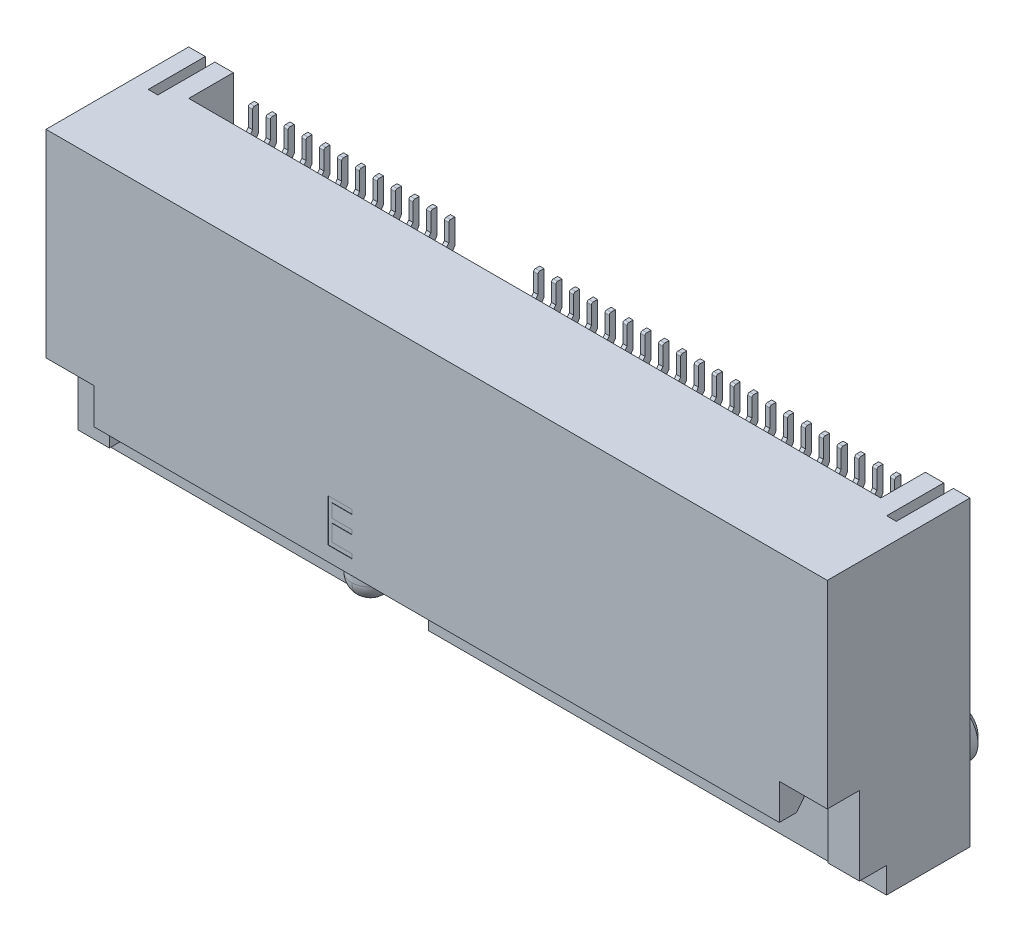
SolidWorks part; units mm, degrees
ref_plane "Front Plane" through (0, 0, 0) normal (0, 0, 1) x (1, 0, 0)
ref_plane "Top Plane" through (0, 0, 0) normal (0, 1, 0) x (1, 0, 0)
ref_plane "Right Plane" through (0, 0, 0) normal (1, 0, 0) x (0, 0, -1)
imported_body "S40BA-1-solid1"
imported_body "upper40-1-solid1"
imported_body "lower40-1-solid1"
imported_body "upper40-2-solid1"
imported_body "lower40-2-solid1"
imported_body "noflotingpad-last-1-solid1"
imported_body "noflotingpad-last-2-solid1"
imported_body "upper40-3-solid1"
imported_body "upper40-4-solid1"
imported_body "lower40-3-solid1"
imported_body "lower40-4-solid1"
imported_body "upper40-5-solid1"
imported_body "upper40-6-solid1"
imported_body "upper40-7-solid1"
imported_body "upper40-8-solid1"
imported_body "upper40-9-solid1"
imported_body "upper40-10-solid1"
imported_body "upper40-11-solid1"
imported_body "upper40-12-solid1"
imported_body "upper40-13-solid1"
imported_body "lower40-5-solid1"
imported_body "lower40-6-solid1"
imported_body "lower40-7-solid1"
imported_body "lower40-8-solid1"
imported_body "lower40-9-solid1"
imported_body "lower40-10-solid1"
imported_body "lower40-11-solid1"
imported_body "lower40-12-solid1"
imported_body "lower40-13-solid1"
imported_body "lower40-14-solid1"
imported_body "lower40-15-solid1"
imported_body "lower40-16-solid1"
imported_body "lower40-17-solid1"
imported_body "lower40-18-solid1"
imported_body "lower40-19-solid1"
imported_body "lower40-20-solid1"
imported_body "lower40-21-solid1"
imported_body "lower40-22-solid1"
imported_body "lower40-23-solid1"
imported_body "lower40-24-solid1"
imported_body "lower40-25-solid1"
imported_body "lower40-26-solid1"
imported_body "lower40-27-solid1"
imported_body "lower40-28-solid1"
imported_body "lower40-29-solid1"
imported_body "lower40-30-solid1"
imported_body "lower40-31-solid1"
imported_body "lower40-32-solid1"
imported_body "lower40-33-solid1"
imported_body "upper40-14-solid1"
imported_body "upper40-15-solid1"
imported_body "upper40-16-solid1"
imported_body "upper40-17-solid1"
imported_body "upper40-18-solid1"
imported_body "upper40-19-solid1"
imported_body "upper40-20-solid1"
imported_body "upper40-21-solid1"
imported_body "upper40-22-solid1"
imported_body "upper40-23-solid1"
imported_body "upper40-24-solid1"
imported_body "upper40-25-solid1"
imported_body "upper40-26-solid1"
imported_body "upper40-27-solid1"
imported_body "upper40-28-solid1"
imported_body "upper40-29-solid1"
imported_body "upper40-30-solid1"
imported_body "upper40-31-solid1"
imported_body "upper40-32-solid1"
imported_body "upper40-33-solid1"
imported_body "lower40-34-solid1"
imported_body "upper40-34-solid1"
sketch "Orogin_Ref" plane through (0, 0, 0) normal (0, 0, 1) x (1, 0, 0)
  line L0 (-10.95, -3.58) -> (-10.95, 2.75)
  line L1 (-10.95, 2.75) -> (10.95, 2.75)
  line L2 (10.95, 2.75) -> (10.95, -3.58)
  line L3 (10.95, -3.58) -> (-10.95, -3.58)
  line L4 (-9.8553, 5.1479) -> (-9.2553, 4.5479)
  line L5 (-9.2553, 4.5479) -> (-8.6553, 5.1479)
  line L6 (-8.6553, 5.1479) -> (-9.8553, 5.1479)
  line L7 (-1.905, 0) -> (1.905, 0)
  line L8 (0, -1.905) -> (0, 1.905)
  line L9 (-9.4, 2.7) -> (-9.4, 4.25)
  line L10 (-9.4, 4.25) -> (-9.1, 4.25)
  line L11 (-9.1, 4.25) -> (-9.1, 2.7)
  line L12 (-9.1, 2.7) -> (-9.4, 2.7)
  line L13 (-8.9, 2.7) -> (-8.9, 4.25)
  line L14 (-8.9, 4.25) -> (-8.6, 4.25)
  line L15 (-8.6, 4.25) -> (-8.6, 2.7)
  line L16 (-8.6, 2.7) -> (-8.9, 2.7)
  line L17 (-8.4, 2.7) -> (-8.4, 4.25)
  line L18 (-8.4, 4.25) -> (-8.1, 4.25)
  line L19 (-8.1, 4.25) -> (-8.1, 2.7)
  line L20 (-8.1, 2.7) -> (-8.4, 2.7)
  line L21 (-7.9, 2.7) -> (-7.9, 4.25)
  line L22 (-7.9, 4.25) -> (-7.6, 4.25)
  line L23 (-7.6, 4.25) -> (-7.6, 2.7)
  line L24 (-7.6, 2.7) -> (-7.9, 2.7)
  line L25 (-7.4, 2.7) -> (-7.4, 4.25)
  line L26 (-7.4, 4.25) -> (-7.1, 4.25)
  line L27 (-7.1, 4.25) -> (-7.1, 2.7)
  line L28 (-7.1, 2.7) -> (-7.4, 2.7)
  line L29 (-6.9, 2.7) -> (-6.9, 4.25)
  line L30 (-6.9, 4.25) -> (-6.6, 4.25)
  line L31 (-6.6, 4.25) -> (-6.6, 2.7)
  line L32 (-6.6, 2.7) -> (-6.9, 2.7)
  line L33 (-6.4, 2.7) -> (-6.4, 4.25)
  line L34 (-6.4, 4.25) -> (-6.1, 4.25)
  line L35 (-6.1, 4.25) -> (-6.1, 2.7)
  line L36 (-6.1, 2.7) -> (-6.4, 2.7)
  line L37 (-5.9, 2.7) -> (-5.9, 4.25)
  line L38 (-5.9, 4.25) -> (-5.6, 4.25)
  line L39 (-5.6, 4.25) -> (-5.6, 2.7)
  line L40 (-5.6, 2.7) -> (-5.9, 2.7)
  line L41 (-5.4, 2.7) -> (-5.4, 4.25)
  line L42 (-5.4, 4.25) -> (-5.1, 4.25)
  line L43 (-5.1, 4.25) -> (-5.1, 2.7)
  line L44 (-5.1, 2.7) -> (-5.4, 2.7)
  line L45 (-4.9, 2.7) -> (-4.9, 4.25)
  line L46 (-4.9, 4.25) -> (-4.6, 4.25)
  line L47 (-4.6, 4.25) -> (-4.6, 2.7)
  line L48 (-4.6, 2.7) -> (-4.9, 2.7)
  line L49 (-4.4, 2.7) -> (-4.4, 4.25)
  line L50 (-4.4, 4.25) -> (-4.1, 4.25)
  line L51 (-4.1, 4.25) -> (-4.1, 2.7)
  line L52 (-4.1, 2.7) -> (-4.4, 2.7)
  line L53 (-3.9, 2.7) -> (-3.9, 4.25)
  line L54 (-3.9, 4.25) -> (-3.6, 4.25)
  line L55 (-3.6, 4.25) -> (-3.6, 2.7)
  line L56 (-3.6, 2.7) -> (-3.9, 2.7)
  line L57 (-1.4, 2.7) -> (-1.4, 4.25)
  line L58 (-1.4, 4.25) -> (-1.1, 4.25)
  line L59 (-1.1, 4.25) -> (-1.1, 2.7)
  line L60 (-1.1, 2.7) -> (-1.4, 2.7)
  line L61 (-0.9, 2.7) -> (-0.9, 4.25)
  line L62 (-0.9, 4.25) -> (-0.6, 4.25)
  line L63 (-0.6, 4.25) -> (-0.6, 2.7)
  line L64 (-0.6, 2.7) -> (-0.9, 2.7)
  line L65 (-0.4, 2.7) -> (-0.4, 4.25)
  line L66 (-0.4, 4.25) -> (-0.1, 4.25)
  line L67 (-0.1, 4.25) -> (-0.1, 2.7)
  line L68 (-0.1, 2.7) -> (-0.4, 2.7)
  line L69 (0.1, 2.7) -> (0.1, 4.25)
  line L70 (0.1, 4.25) -> (0.4, 4.25)
  line L71 (0.4, 4.25) -> (0.4, 2.7)
  line L72 (0.4, 2.7) -> (0.1, 2.7)
  line L73 (0.6, 2.7) -> (0.6, 4.25)
  line L74 (0.6, 4.25) -> (0.9, 4.25)
  line L75 (0.9, 4.25) -> (0.9, 2.7)
  line L76 (0.9, 2.7) -> (0.6, 2.7)
  line L77 (1.1, 2.7) -> (1.1, 4.25)
  line L78 (1.1, 4.25) -> (1.4, 4.25)
  line L79 (1.4, 4.25) -> (1.4, 2.7)
  line L80 (1.4, 2.7) -> (1.1, 2.7)
  line L81 (1.6, 2.7) -> (1.6, 4.25)
  line L82 (1.6, 4.25) -> (1.9, 4.25)
  line L83 (1.9, 4.25) -> (1.9, 2.7)
  line L84 (1.9, 2.7) -> (1.6, 2.7)
  line L85 (2.1, 2.7) -> (2.1, 4.25)
  line L86 (2.1, 4.25) -> (2.4, 4.25)
  line L87 (2.4, 4.25) -> (2.4, 2.7)
  line L88 (2.4, 2.7) -> (2.1, 2.7)
  line L89 (2.6, 2.7) -> (2.6, 4.25)
  line L90 (2.6, 4.25) -> (2.9, 4.25)
  line L91 (2.9, 4.25) -> (2.9, 2.7)
  line L92 (2.9, 2.7) -> (2.6, 2.7)
  line L93 (3.1, 2.7) -> (3.1, 4.25)
  line L94 (3.1, 4.25) -> (3.4, 4.25)
  line L95 (3.4, 4.25) -> (3.4, 2.7)
  line L96 (3.4, 2.7) -> (3.1, 2.7)
  line L97 (3.6, 2.7) -> (3.6, 4.25)
  line L98 (3.6, 4.25) -> (3.9, 4.25)
  line L99 (3.9, 4.25) -> (3.9, 2.7)
  line L100 (3.9, 2.7) -> (3.6, 2.7)
  line L101 (4.1, 2.7) -> (4.1, 4.25)
  line L102 (4.1, 4.25) -> (4.4, 4.25)
  line L103 (4.4, 4.25) -> (4.4, 2.7)
  line L104 (4.4, 2.7) -> (4.1, 2.7)
  line L105 (4.6, 2.7) -> (4.6, 4.25)
  line L106 (4.6, 4.25) -> (4.9, 4.25)
  line L107 (4.9, 4.25) -> (4.9, 2.7)
  line L108 (4.9, 2.7) -> (4.6, 2.7)
  line L109 (5.1, 2.7) -> (5.1, 4.25)
  line L110 (5.1, 4.25) -> (5.4, 4.25)
  line L111 (5.4, 4.25) -> (5.4, 2.7)
  line L112 (5.4, 2.7) -> (5.1, 2.7)
  line L113 (5.6, 2.7) -> (5.6, 4.25)
  line L114 (5.6, 4.25) -> (5.9, 4.25)
  line L115 (5.9, 4.25) -> (5.9, 2.7)
  line L116 (5.9, 2.7) -> (5.6, 2.7)
  line L117 (6.1, 2.7) -> (6.1, 4.25)
  line L118 (6.1, 4.25) -> (6.4, 4.25)
  line L119 (6.4, 4.25) -> (6.4, 2.7)
  line L120 (6.4, 2.7) -> (6.1, 2.7)
  line L121 (6.6, 2.7) -> (6.6, 4.25)
  line L122 (6.6, 4.25) -> (6.9, 4.25)
  line L123 (6.9, 4.25) -> (6.9, 2.7)
  line L124 (6.9, 2.7) -> (6.6, 2.7)
  line L125 (7.1, 2.7) -> (7.1, 4.25)
  line L126 (7.1, 4.25) -> (7.4, 4.25)
  line L127 (7.4, 4.25) -> (7.4, 2.7)
  line L128 (7.4, 2.7) -> (7.1, 2.7)
  line L129 (7.6, 2.7) -> (7.6, 4.25)
  line L130 (7.6, 4.25) -> (7.9, 4.25)
  line L131 (7.9, 4.25) -> (7.9, 2.7)
  line L132 (7.9, 2.7) -> (7.6, 2.7)
  line L133 (8.1, 2.7) -> (8.1, 4.25)
  line L134 (8.1, 4.25) -> (8.4, 4.25)
  line L135 (8.4, 4.25) -> (8.4, 2.7)
  line L136 (8.4, 2.7) -> (8.1, 2.7)
  line L137 (8.6, 2.7) -> (8.6, 4.25)
  line L138 (8.6, 4.25) -> (8.9, 4.25)
  line L139 (8.9, 4.25) -> (8.9, 2.7)
  line L140 (8.9, 2.7) -> (8.6, 2.7)
  line L141 (9.1, 2.7) -> (9.1, 4.25)
  line L142 (9.1, 4.25) -> (9.4, 4.25)
  line L143 (9.4, 4.25) -> (9.4, 2.7)
  line L144 (9.4, 2.7) -> (9.1, 2.7)
  line L145 (-9.15, -4.75) -> (-9.15, -3.2)
  line L146 (-9.15, -3.2) -> (-8.85, -3.2)
  line L147 (-8.85, -3.2) -> (-8.85, -4.75)
  line L148 (-8.85, -4.75) -> (-9.15, -4.75)
  line L149 (-8.65, -4.75) -> (-8.65, -3.2)
  line L150 (-8.65, -3.2) -> (-8.35, -3.2)
  line L151 (-8.35, -3.2) -> (-8.35, -4.75)
  line L152 (-8.35, -4.75) -> (-8.65, -4.75)
  line L153 (-8.15, -4.75) -> (-8.15, -3.2)
  line L154 (-8.15, -3.2) -> (-7.85, -3.2)
  line L155 (-7.85, -3.2) -> (-7.85, -4.75)
  line L156 (-7.85, -4.75) -> (-8.15, -4.75)
  line L157 (-7.65, -4.75) -> (-7.65, -3.2)
  line L158 (-7.65, -3.2) -> (-7.35, -3.2)
  line L159 (-7.35, -3.2) -> (-7.35, -4.75)
  line L160 (-7.35, -4.75) -> (-7.65, -4.75)
  line L161 (-7.15, -4.75) -> (-7.15, -3.2)
  line L162 (-7.15, -3.2) -> (-6.85, -3.2)
  line L163 (-6.85, -3.2) -> (-6.85, -4.75)
  line L164 (-6.85, -4.75) -> (-7.15, -4.75)
  line L165 (-6.65, -4.75) -> (-6.65, -3.2)
  line L166 (-6.65, -3.2) -> (-6.35, -3.2)
  line L167 (-6.35, -3.2) -> (-6.35, -4.75)
  line L168 (-6.35, -4.75) -> (-6.65, -4.75)
  line L169 (-6.15, -4.75) -> (-6.15, -3.2)
  line L170 (-6.15, -3.2) -> (-5.85, -3.2)
  line L171 (-5.85, -3.2) -> (-5.85, -4.75)
  line L172 (-5.85, -4.75) -> (-6.15, -4.75)
  line L173 (-5.65, -4.75) -> (-5.65, -3.2)
  line L174 (-5.65, -3.2) -> (-5.35, -3.2)
  line L175 (-5.35, -3.2) -> (-5.35, -4.75)
  line L176 (-5.35, -4.75) -> (-5.65, -4.75)
  line L177 (-5.15, -4.75) -> (-5.15, -3.2)
  line L178 (-5.15, -3.2) -> (-4.85, -3.2)
  line L179 (-4.85, -3.2) -> (-4.85, -4.75)
  line L180 (-4.85, -4.75) -> (-5.15, -4.75)
  line L181 (-4.65, -4.75) -> (-4.65, -3.2)
  line L182 (-4.65, -3.2) -> (-4.35, -3.2)
  line L183 (-4.35, -3.2) -> (-4.35, -4.75)
  line L184 (-4.35, -4.75) -> (-4.65, -4.75)
  line L185 (-4.15, -4.75) -> (-4.15, -3.2)
  line L186 (-4.15, -3.2) -> (-3.85, -3.2)
  line L187 (-3.85, -3.2) -> (-3.85, -4.75)
  line L188 (-3.85, -4.75) -> (-4.15, -4.75)
  line L189 (-1.65, -4.75) -> (-1.65, -3.2)
  line L190 (-1.65, -3.2) -> (-1.35, -3.2)
  line L191 (-1.35, -3.2) -> (-1.35, -4.75)
  line L192 (-1.35, -4.75) -> (-1.65, -4.75)
  line L193 (-1.15, -4.75) -> (-1.15, -3.2)
  line L194 (-1.15, -3.2) -> (-0.85, -3.2)
  line L195 (-0.85, -3.2) -> (-0.85, -4.75)
  line L196 (-0.85, -4.75) -> (-1.15, -4.75)
  line L197 (-0.65, -4.75) -> (-0.65, -3.2)
  line L198 (-0.65, -3.2) -> (-0.35, -3.2)
  line L199 (-0.35, -3.2) -> (-0.35, -4.75)
  line L200 (-0.35, -4.75) -> (-0.65, -4.75)
  line L201 (-0.15, -4.75) -> (-0.15, -3.2)
  line L202 (-0.15, -3.2) -> (0.15, -3.2)
  line L203 (0.15, -3.2) -> (0.15, -4.75)
  line L204 (0.15, -4.75) -> (-0.15, -4.75)
  line L205 (0.35, -4.75) -> (0.35, -3.2)
  line L206 (0.35, -3.2) -> (0.65, -3.2)
  line L207 (0.65, -3.2) -> (0.65, -4.75)
  line L208 (0.65, -4.75) -> (0.35, -4.75)
  line L209 (0.85, -4.75) -> (0.85, -3.2)
  line L210 (0.85, -3.2) -> (1.15, -3.2)
  line L211 (1.15, -3.2) -> (1.15, -4.75)
  line L212 (1.15, -4.75) -> (0.85, -4.75)
  line L213 (1.35, -4.75) -> (1.35, -3.2)
  line L214 (1.35, -3.2) -> (1.65, -3.2)
  line L215 (1.65, -3.2) -> (1.65, -4.75)
  line L216 (1.65, -4.75) -> (1.35, -4.75)
  line L217 (1.85, -4.75) -> (1.85, -3.2)
  line L218 (1.85, -3.2) -> (2.15, -3.2)
  line L219 (2.15, -3.2) -> (2.15, -4.75)
  line L220 (2.15, -4.75) -> (1.85, -4.75)
  line L221 (2.35, -4.75) -> (2.35, -3.2)
  line L222 (2.35, -3.2) -> (2.65, -3.2)
  line L223 (2.65, -3.2) -> (2.65, -4.75)
  line L224 (2.65, -4.75) -> (2.35, -4.75)
  line L225 (2.85, -4.75) -> (2.85, -3.2)
  line L226 (2.85, -3.2) -> (3.15, -3.2)
  line L227 (3.15, -3.2) -> (3.15, -4.75)
  line L228 (3.15, -4.75) -> (2.85, -4.75)
  line L229 (3.35, -4.75) -> (3.35, -3.2)
  line L230 (3.35, -3.2) -> (3.65, -3.2)
  line L231 (3.65, -3.2) -> (3.65, -4.75)
  line L232 (3.65, -4.75) -> (3.35, -4.75)
  line L233 (3.85, -4.75) -> (3.85, -3.2)
  line L234 (3.85, -3.2) -> (4.15, -3.2)
  line L235 (4.15, -3.2) -> (4.15, -4.75)
  line L236 (4.15, -4.75) -> (3.85, -4.75)
  line L237 (4.35, -4.75) -> (4.35, -3.2)
  line L238 (4.35, -3.2) -> (4.65, -3.2)
  line L239 (4.65, -3.2) -> (4.65, -4.75)
  line L240 (4.65, -4.75) -> (4.35, -4.75)
  line L241 (4.85, -4.75) -> (4.85, -3.2)
  line L242 (4.85, -3.2) -> (5.15, -3.2)
  line L243 (5.15, -3.2) -> (5.15, -4.75)
  line L244 (5.15, -4.75) -> (4.85, -4.75)
  line L245 (5.35, -4.75) -> (5.35, -3.2)
  line L246 (5.35, -3.2) -> (5.65, -3.2)
  line L247 (5.65, -3.2) -> (5.65, -4.75)
  line L248 (5.65, -4.75) -> (5.35, -4.75)
  line L249 (5.85, -4.75) -> (5.85, -3.2)
  line L250 (5.85, -3.2) -> (6.15, -3.2)
  line L251 (6.15, -3.2) -> (6.15, -4.75)
  line L252 (6.15, -4.75) -> (5.85, -4.75)
  line L253 (6.35, -4.75) -> (6.35, -3.2)
  line L254 (6.35, -3.2) -> (6.65, -3.2)
  line L255 (6.65, -3.2) -> (6.65, -4.75)
  line L256 (6.65, -4.75) -> (6.35, -4.75)
  line L257 (6.85, -4.75) -> (6.85, -3.2)
  line L258 (6.85, -3.2) -> (7.15, -3.2)
  line L259 (7.15, -3.2) -> (7.15, -4.75)
  line L260 (7.15, -4.75) -> (6.85, -4.75)
  line L261 (7.35, -4.75) -> (7.35, -3.2)
  line L262 (7.35, -3.2) -> (7.65, -3.2)
  line L263 (7.65, -3.2) -> (7.65, -4.75)
  line L264 (7.65, -4.75) -> (7.35, -4.75)
  line L265 (7.85, -4.75) -> (7.85, -3.2)
  line L266 (7.85, -3.2) -> (8.15, -3.2)
  line L267 (8.15, -3.2) -> (8.15, -4.75)
  line L268 (8.15, -4.75) -> (7.85, -4.75)
  line L269 (8.35, -4.75) -> (8.35, -3.2)
  line L270 (8.35, -3.2) -> (8.65, -3.2)
  line L271 (8.65, -3.2) -> (8.65, -4.75)
  line L272 (8.65, -4.75) -> (8.35, -4.75)
  line L273 (8.85, -4.75) -> (8.85, -3.2)
  line L274 (8.85, -3.2) -> (9.15, -3.2)
  line L275 (9.15, -3.2) -> (9.15, -4.75)
  line L276 (9.15, -4.75) -> (8.85, -4.75)
  line L277 (-10.95, 1.375) -> (-10.95, 4.125)
  line L278 (-10.95, 4.125) -> (-9.75, 4.125)
  line L279 (-9.75, 4.125) -> (-9.75, 1.375)
  line L280 (-9.75, 1.375) -> (-10.95, 1.375)
  line L281 (9.75, 1.375) -> (9.75, 4.125)
  line L282 (9.75, 4.125) -> (10.95, 4.125)
  line L283 (10.95, 4.125) -> (10.95, 1.375)
  line L284 (10.95, 1.375) -> (9.75, 1.375)
  line L285 (-10.95, -3.58) -> (-10.95, 2.75)
  line L286 (-10.95, 2.75) -> (10.95, 2.75)
  line L287 (10.95, 2.75) -> (10.95, -3.58)
  line L288 (10.95, -3.58) -> (-10.95, -3.58)
  line L289 (-9.25, 4.25) -> (-9.25, 2.7) construction
  circle A0 centre (0, 0) radius 1
  text T0 "B" font "ARIAL" height 1
  text T1 "1" font "COURIER NEW" height 0.508
  text T2 "3" font "COURIER NEW" height 0.508
  text T3 "5" font "COURIER NEW" height 0.508
  text T4 "7" font "COURIER NEW" height 0.508
  text T5 "9" font "COURIER NEW" height 0.508
  text T6 "11" font "COURIER NEW" height 0.508
  text T7 "13" font "COURIER NEW" height 0.508
  text T8 "15" font "COURIER NEW" height 0.508
  text T9 "17" font "COURIER NEW" height 0.508
  text T10 "19" font "COURIER NEW" height 0.508
  text T11 "21" font "COURIER NEW" height 0.508
  text T12 "23" font "COURIER NEW" height 0.508
  text T13 "33" font "COURIER NEW" height 0.508
  text T14 "35" font "COURIER NEW" height 0.508
  text T15 "37" font "COURIER NEW" height 0.508
  text T16 "39" font "COURIER NEW" height 0.508
  text T17 "41" font "COURIER NEW" height 0.508
  text T18 "43" font "COURIER NEW" height 0.508
  text T19 "45" font "COURIER NEW" height 0.508
  text T20 "47" font "COURIER NEW" height 0.508
  text T21 "49" font "COURIER NEW" height 0.508
  text T22 "51" font "COURIER NEW" height 0.508
  text T23 "53" font "COURIER NEW" height 0.508
  text T24 "55" font "COURIER NEW" height 0.508
  text T25 "57" font "COURIER NEW" height 0.508
  text T26 "59" font "COURIER NEW" height 0.508
  text T27 "61" font "COURIER NEW" height 0.508
  text T28 "63" font "COURIER NEW" height 0.508
  text T29 "65" font "COURIER NEW" height 0.508
  text T30 "67" font "COURIER NEW" height 0.508
  text T31 "69" font "COURIER NEW" height 0.508
  text T32 "71" font "COURIER NEW" height 0.508
  text T33 "73" font "COURIER NEW" height 0.508
  text T34 "75" font "COURIER NEW" height 0.508
  text T35 "2" font "COURIER NEW" height 0.508
  text T36 "4" font "COURIER NEW" height 0.508
  text T37 "6" font "COURIER NEW" height 0.508
  text T38 "8" font "COURIER NEW" height 0.508
  text T39 "10" font "COURIER NEW" height 0.508
  text T40 "12" font "COURIER NEW" height 0.508
  text T41 "14" font "COURIER NEW" height 0.508
  text T42 "16" font "COURIER NEW" height 0.508
  text T43 "18" font "COURIER NEW" height 0.508
  text T44 "20" font "COURIER NEW" height 0.508
  text T45 "22" font "COURIER NEW" height 0.508
  text T46 "32" font "COURIER NEW" height 0.508
  text T47 "34" font "COURIER NEW" height 0.508
  text T48 "36" font "COURIER NEW" height 0.508
  text T49 "38" font "COURIER NEW" height 0.508
  text T50 "40" font "COURIER NEW" height 0.508
  text T51 "42" font "COURIER NEW" height 0.508
  text T52 "44" font "COURIER NEW" height 0.508
  text T53 "46" font "COURIER NEW" height 0.508
  text T54 "48" font "COURIER NEW" height 0.508
  text T55 "50" font "COURIER NEW" height 0.508
  text T56 "52" font "COURIER NEW" height 0.508
  text T57 "54" font "COURIER NEW" height 0.508
  text T58 "56" font "COURIER NEW" height 0.508
  text T59 "58" font "COURIER NEW" height 0.508
  text T60 "60" font "COURIER NEW" height 0.508
  text T61 "62" font "COURIER NEW" height 0.508
  text T62 "64" font "COURIER NEW" height 0.508
  text T63 "66" font "COURIER NEW" height 0.508
  text T64 "68" font "COURIER NEW" height 0.508
  text T65 "70" font "COURIER NEW" height 0.508
  text T66 "72" font "COURIER NEW" height 0.508
  text T67 "74" font "COURIER NEW" height 0.508
  text T68 "NC1" font "COURIER NEW" height 0.508
  text T69 "NC2" font "COURIER NEW" height 0.508
sketch "Origin_Ref" plane through (130.0926, -40.2153, 0) normal (0, 0, 1) x (0, 1, 0)
  line L286 (37.0153, 134.2426) -> (35.4653, 134.2426)
  line L287 (37.0153, 133.9426) -> (37.0153, 134.2426)
  line L288 (35.4653, 133.9426) -> (37.0153, 133.9426)
  line L289 (35.4653, 134.2426) -> (35.4653, 133.9426)
  line L290 (37.0153, 134.7426) -> (35.4653, 134.7426)
  line L291 (37.0153, 134.4426) -> (37.0153, 134.7426)
  line L292 (35.4653, 134.4426) -> (37.0153, 134.4426)
  line L293 (35.4653, 134.7426) -> (35.4653, 134.4426)
  line L294 (37.0153, 121.2426) -> (35.4653, 121.2426)
  line L295 (37.0153, 120.9426) -> (37.0153, 121.2426)
  line L296 (35.4653, 120.9426) -> (37.0153, 120.9426)
  line L297 (35.4653, 121.2426) -> (35.4653, 120.9426)
  line L298 (37.0153, 121.7426) -> (35.4653, 121.7426)
  line L299 (37.0153, 121.4426) -> (37.0153, 121.7426)
  line L300 (35.4653, 121.4426) -> (37.0153, 121.4426)
  line L301 (35.4653, 121.7426) -> (35.4653, 121.4426)
  line L302 (37.0153, 122.2426) -> (35.4653, 122.2426)
  line L303 (37.0153, 121.9426) -> (37.0153, 122.2426)
  line L304 (35.4653, 121.9426) -> (37.0153, 121.9426)
  line L305 (35.4653, 122.2426) -> (35.4653, 121.9426)
  line L306 (37.0153, 122.7426) -> (35.4653, 122.7426)
  line L307 (37.0153, 122.4426) -> (37.0153, 122.7426)
  line L308 (35.4653, 122.4426) -> (37.0153, 122.4426)
  line L309 (35.4653, 122.7426) -> (35.4653, 122.4426)
  line L310 (37.0153, 123.2426) -> (35.4653, 123.2426)
  line L311 (37.0153, 122.9426) -> (37.0153, 123.2426)
  line L312 (35.4653, 122.9426) -> (37.0153, 122.9426)
  line L313 (35.4653, 123.2426) -> (35.4653, 122.9426)
  line L314 (37.0153, 123.7426) -> (35.4653, 123.7426)
  line L315 (37.0153, 123.4426) -> (37.0153, 123.7426)
  line L316 (35.4653, 123.4426) -> (37.0153, 123.4426)
  line L317 (35.4653, 123.7426) -> (35.4653, 123.4426)
  line L318 (37.0153, 124.2426) -> (35.4653, 124.2426)
  line L319 (37.0153, 123.9426) -> (37.0153, 124.2426)
  line L320 (35.4653, 123.9426) -> (37.0153, 123.9426)
  line L321 (35.4653, 124.2426) -> (35.4653, 123.9426)
  line L322 (37.0153, 124.7426) -> (35.4653, 124.7426)
  line L323 (37.0153, 124.4426) -> (37.0153, 124.7426)
  line L324 (35.4653, 124.4426) -> (37.0153, 124.4426)
  line L325 (35.4653, 124.7426) -> (35.4653, 124.4426)
  line L326 (37.0153, 125.2426) -> (35.4653, 125.2426)
  line L327 (37.0153, 124.9426) -> (37.0153, 125.2426)
  line L328 (35.4653, 124.9426) -> (37.0153, 124.9426)
  line L329 (35.4653, 125.2426) -> (35.4653, 124.9426)
  line L330 (37.0153, 125.7426) -> (35.4653, 125.7426)
  line L331 (37.0153, 125.4426) -> (37.0153, 125.7426)
  line L332 (35.4653, 125.4426) -> (37.0153, 125.4426)
  line L333 (35.4653, 125.7426) -> (35.4653, 125.4426)
  line L334 (37.0153, 126.2426) -> (35.4653, 126.2426)
  line L335 (37.0153, 125.9426) -> (37.0153, 126.2426)
  line L336 (35.4653, 125.9426) -> (37.0153, 125.9426)
  line L337 (35.4653, 126.2426) -> (35.4653, 125.9426)
  line L338 (37.0153, 126.7426) -> (35.4653, 126.7426)
  line L339 (37.0153, 126.4426) -> (37.0153, 126.7426)
  line L340 (35.4653, 126.4426) -> (37.0153, 126.4426)
  line L341 (35.4653, 126.7426) -> (35.4653, 126.4426)
  line L342 (37.0153, 127.2426) -> (35.4653, 127.2426)
  line L343 (37.0153, 126.9426) -> (37.0153, 127.2426)
  line L344 (35.4653, 126.9426) -> (37.0153, 126.9426)
  line L345 (35.4653, 127.2426) -> (35.4653, 126.9426)
  line L346 (37.0153, 127.7426) -> (35.4653, 127.7426)
  line L347 (37.0153, 127.4426) -> (37.0153, 127.7426)
  line L348 (35.4653, 127.4426) -> (37.0153, 127.4426)
  line L349 (35.4653, 127.7426) -> (35.4653, 127.4426)
  line L350 (37.0153, 128.2426) -> (35.4653, 128.2426)
  line L351 (37.0153, 127.9426) -> (37.0153, 128.2426)
  line L352 (35.4653, 127.9426) -> (37.0153, 127.9426)
  line L353 (35.4653, 128.2426) -> (35.4653, 127.9426)
  line L354 (37.0153, 128.7426) -> (35.4653, 128.7426)
  line L355 (37.0153, 128.4426) -> (37.0153, 128.7426)
  line L356 (35.4653, 128.4426) -> (37.0153, 128.4426)
  line L357 (35.4653, 128.7426) -> (35.4653, 128.4426)
  line L358 (37.0153, 135.2426) -> (35.4653, 135.2426)
  line L359 (37.0153, 134.9426) -> (37.0153, 135.2426)
  line L360 (35.4653, 134.9426) -> (37.0153, 134.9426)
  line L361 (35.4653, 135.2426) -> (35.4653, 134.9426)
  line L362 (37.0153, 135.7426) -> (35.4653, 135.7426)
  line L363 (37.0153, 135.4426) -> (37.0153, 135.7426)
  line L364 (35.4653, 135.4426) -> (37.0153, 135.4426)
  line L365 (35.4653, 135.7426) -> (35.4653, 135.4426)
  line L366 (37.0153, 136.2426) -> (35.4653, 136.2426)
  line L367 (37.0153, 135.9426) -> (37.0153, 136.2426)
  line L368 (35.4653, 135.9426) -> (37.0153, 135.9426)
  line L369 (35.4653, 136.2426) -> (35.4653, 135.9426)
  line L370 (37.0153, 136.7426) -> (35.4653, 136.7426)
  line L371 (37.0153, 136.4426) -> (37.0153, 136.7426)
  line L372 (35.4653, 136.4426) -> (37.0153, 136.4426)
  line L373 (35.4653, 136.7426) -> (35.4653, 136.4426)
  line L374 (37.0153, 137.2426) -> (35.4653, 137.2426)
  line L375 (37.0153, 136.9426) -> (37.0153, 137.2426)
  line L376 (35.4653, 136.9426) -> (37.0153, 136.9426)
  line L377 (35.4653, 137.2426) -> (35.4653, 136.9426)
  line L378 (37.0153, 137.7426) -> (35.4653, 137.7426)
  line L379 (37.0153, 137.4426) -> (37.0153, 137.7426)
  line L380 (35.4653, 137.4426) -> (37.0153, 137.4426)
  line L381 (35.4653, 137.7426) -> (35.4653, 137.4426)
  line L382 (37.0153, 138.2426) -> (35.4653, 138.2426)
  line L383 (37.0153, 137.9426) -> (37.0153, 138.2426)
  line L384 (35.4653, 137.9426) -> (37.0153, 137.9426)
  line L385 (35.4653, 138.2426) -> (35.4653, 137.9426)
  line L386 (37.0153, 138.7426) -> (35.4653, 138.7426)
  line L387 (37.0153, 138.4426) -> (37.0153, 138.7426)
  line L388 (35.4653, 138.4426) -> (37.0153, 138.4426)
  line L389 (35.4653, 138.7426) -> (35.4653, 138.4426)
  line L390 (37.0153, 139.2426) -> (35.4653, 139.2426)
  line L391 (37.0153, 138.9426) -> (37.0153, 139.2426)
  line L392 (35.4653, 138.9426) -> (37.0153, 138.9426)
  line L393 (35.4653, 139.2426) -> (35.4653, 138.9426)
  line L394 (37.0153, 129.2426) -> (35.4653, 129.2426)
  line L395 (37.0153, 128.9426) -> (37.0153, 129.2426)
  line L396 (35.4653, 128.9426) -> (37.0153, 128.9426)
  line L397 (35.4653, 129.2426) -> (35.4653, 128.9426)
  line L398 (37.0153, 129.7426) -> (35.4653, 129.7426)
  line L399 (37.0153, 129.4426) -> (37.0153, 129.7426)
  line L400 (35.4653, 129.4426) -> (37.0153, 129.4426)
  line L401 (35.4653, 129.7426) -> (35.4653, 129.4426)
  line L402 (37.0153, 130.2426) -> (35.4653, 130.2426)
  line L403 (37.0153, 129.9426) -> (37.0153, 130.2426)
  line L404 (35.4653, 129.9426) -> (37.0153, 129.9426)
  line L405 (35.4653, 130.2426) -> (35.4653, 129.9426)
  line L406 (37.0153, 130.7426) -> (35.4653, 130.7426)
  line L407 (37.0153, 130.4426) -> (37.0153, 130.7426)
  line L408 (35.4653, 130.4426) -> (37.0153, 130.4426)
  line L409 (35.4653, 130.7426) -> (35.4653, 130.4426)
  line L410 (37.0153, 131.2426) -> (35.4653, 131.2426)
  line L411 (37.0153, 130.9426) -> (37.0153, 131.2426)
  line L412 (35.4653, 130.9426) -> (37.0153, 130.9426)
  line L413 (35.4653, 131.2426) -> (35.4653, 130.9426)
  line L414 (37.0153, 131.7426) -> (35.4653, 131.7426)
  line L415 (37.0153, 131.4426) -> (37.0153, 131.7426)
  line L416 (35.4653, 131.4426) -> (37.0153, 131.4426)
  line L417 (35.4653, 131.7426) -> (35.4653, 131.4426)
  line L418 (44.3403, 120.3426) -> (41.5903, 120.3426)
  line L419 (44.3403, 119.1426) -> (44.3403, 120.3426)
  line L420 (41.5903, 119.1426) -> (44.3403, 119.1426)
  line L421 (41.5903, 120.3426) -> (41.5903, 119.1426)
  line L422 (44.4653, 120.9926) -> (42.9153, 120.9926)
  line L423 (44.4653, 120.6926) -> (44.4653, 120.9926)
  line L424 (42.9153, 120.6926) -> (44.4653, 120.6926)
  line L425 (42.9153, 120.9926) -> (42.9153, 120.6926)
  line L426 (44.4653, 121.4926) -> (42.9153, 121.4926)
  line L427 (44.4653, 121.1926) -> (44.4653, 121.4926)
  line L428 (42.9153, 121.1926) -> (44.4653, 121.1926)
  line L429 (42.9153, 121.4926) -> (42.9153, 121.1926)
  line L430 (44.4653, 121.9926) -> (42.9153, 121.9926)
  line L431 (44.4653, 121.6926) -> (44.4653, 121.9926)
  line L432 (42.9153, 121.6926) -> (44.4653, 121.6926)
  line L433 (42.9153, 121.9926) -> (42.9153, 121.6926)
  line L434 (44.4653, 122.4926) -> (42.9153, 122.4926)
  line L435 (44.4653, 122.1926) -> (44.4653, 122.4926)
  line L436 (42.9153, 122.1926) -> (44.4653, 122.1926)
  line L437 (42.9153, 122.4926) -> (42.9153, 122.1926)
  line L438 (44.4653, 122.9926) -> (42.9153, 122.9926)
  line L439 (44.4653, 122.6926) -> (44.4653, 122.9926)
  line L440 (42.9153, 122.6926) -> (44.4653, 122.6926)
  line L441 (42.9153, 122.9926) -> (42.9153, 122.6926)
  line L442 (44.4653, 123.4926) -> (42.9153, 123.4926)
  line L443 (44.4653, 123.1926) -> (44.4653, 123.4926)
  line L444 (42.9153, 123.1926) -> (44.4653, 123.1926)
  line L445 (42.9153, 123.4926) -> (42.9153, 123.1926)
  line L446 (44.4653, 123.9926) -> (42.9153, 123.9926)
  line L447 (44.4653, 123.6926) -> (44.4653, 123.9926)
  line L448 (42.9153, 123.6926) -> (44.4653, 123.6926)
  line L449 (42.9153, 123.9926) -> (42.9153, 123.6926)
  line L450 (44.4653, 124.4926) -> (42.9153, 124.4926)
  line L451 (44.4653, 124.1926) -> (44.4653, 124.4926)
  line L452 (42.9153, 124.1926) -> (44.4653, 124.1926)
  line L453 (42.9153, 124.4926) -> (42.9153, 124.1926)
  line L454 (44.4653, 124.9926) -> (42.9153, 124.9926)
  line L455 (44.4653, 124.6926) -> (44.4653, 124.9926)
  line L456 (42.9153, 124.6926) -> (44.4653, 124.6926)
  line L457 (42.9153, 124.9926) -> (42.9153, 124.6926)
  line L458 (44.4653, 125.4926) -> (42.9153, 125.4926)
  line L459 (44.4653, 125.1926) -> (44.4653, 125.4926)
  line L460 (42.9153, 125.1926) -> (44.4653, 125.1926)
  line L461 (42.9153, 125.4926) -> (42.9153, 125.1926)
  line L462 (44.4653, 128.9926) -> (42.9153, 128.9926)
  line L463 (44.4653, 128.6926) -> (44.4653, 128.9926)
  line L464 (42.9153, 128.6926) -> (44.4653, 128.6926)
  line L465 (42.9153, 128.9926) -> (42.9153, 128.6926)
  line L466 (44.4653, 129.4926) -> (42.9153, 129.4926)
  line L467 (44.4653, 129.1926) -> (44.4653, 129.4926)
  line L468 (42.9153, 129.1926) -> (44.4653, 129.1926)
  line L469 (42.9153, 129.4926) -> (42.9153, 129.1926)
  line L470 (44.4653, 129.9926) -> (42.9153, 129.9926)
  line L471 (44.4653, 129.6926) -> (44.4653, 129.9926)
  line L472 (42.9153, 129.6926) -> (44.4653, 129.6926)
  line L473 (42.9153, 129.9926) -> (42.9153, 129.6926)
  line L474 (44.4653, 130.4926) -> (42.9153, 130.4926)
  line L475 (44.4653, 130.1926) -> (44.4653, 130.4926)
  line L476 (42.9153, 130.1926) -> (44.4653, 130.1926)
  line L477 (42.9153, 130.4926) -> (42.9153, 130.1926)
  line L478 (44.4653, 130.9926) -> (42.9153, 130.9926)
  line L479 (44.4653, 130.6926) -> (44.4653, 130.9926)
  line L480 (42.9153, 130.6926) -> (44.4653, 130.6926)
  line L481 (42.9153, 130.9926) -> (42.9153, 130.6926)
  line L482 (44.4653, 131.4926) -> (42.9153, 131.4926)
  line L483 (44.4653, 131.1926) -> (44.4653, 131.4926)
  line L484 (42.9153, 131.1926) -> (44.4653, 131.1926)
  line L485 (42.9153, 131.4926) -> (42.9153, 131.1926)
  line L486 (44.4653, 133.9926) -> (42.9153, 133.9926)
  line L487 (44.4653, 133.6926) -> (44.4653, 133.9926)
  line L488 (42.9153, 133.6926) -> (44.4653, 133.6926)
  line L489 (42.9153, 133.9926) -> (42.9153, 133.6926)
  line L490 (44.4653, 134.4926) -> (42.9153, 134.4926)
  line L491 (44.4653, 134.1926) -> (44.4653, 134.4926)
  line L492 (42.9153, 134.1926) -> (44.4653, 134.1926)
  line L493 (42.9153, 134.4926) -> (42.9153, 134.1926)
  line L494 (44.4653, 134.9926) -> (42.9153, 134.9926)
  line L495 (44.4653, 134.6926) -> (44.4653, 134.9926)
  line L496 (42.9153, 134.6926) -> (44.4653, 134.6926)
  line L497 (42.9153, 134.9926) -> (42.9153, 134.6926)
  line L498 (44.4653, 135.4926) -> (42.9153, 135.4926)
  line L499 (44.4653, 135.1926) -> (44.4653, 135.4926)
  line L500 (42.9153, 135.1926) -> (44.4653, 135.1926)
  line L501 (42.9153, 135.4926) -> (42.9153, 135.1926)
  line L502 (44.4653, 135.9926) -> (42.9153, 135.9926)
  line L503 (44.4653, 135.6926) -> (44.4653, 135.9926)
  line L504 (42.9153, 135.6926) -> (44.4653, 135.6926)
  line L505 (42.9153, 135.9926) -> (42.9153, 135.6926)
  line L506 (44.4653, 136.4926) -> (42.9153, 136.4926)
  line L507 (44.4653, 136.1926) -> (44.4653, 136.4926)
  line L508 (42.9153, 136.1926) -> (44.4653, 136.1926)
  line L509 (42.9153, 136.4926) -> (42.9153, 136.1926)
  line L510 (44.4653, 136.9926) -> (42.9153, 136.9926)
  line L511 (44.4653, 136.6926) -> (44.4653, 136.9926)
  line L512 (42.9153, 136.6926) -> (44.4653, 136.6926)
  line L513 (42.9153, 136.9926) -> (42.9153, 136.6926)
  line L514 (44.4653, 137.4926) -> (42.9153, 137.4926)
  line L515 (44.4653, 137.1926) -> (44.4653, 137.4926)
  line L516 (42.9153, 137.1926) -> (44.4653, 137.1926)
  line L517 (42.9153, 137.4926) -> (42.9153, 137.1926)
  line L518 (44.4653, 137.9926) -> (42.9153, 137.9926)
  line L519 (44.4653, 137.6926) -> (44.4653, 137.9926)
  line L520 (42.9153, 137.6926) -> (44.4653, 137.6926)
  line L521 (42.9153, 137.9926) -> (42.9153, 137.6926)
  line L522 (44.4653, 138.4926) -> (42.9153, 138.4926)
  line L523 (44.4653, 138.1926) -> (44.4653, 138.4926)
  line L524 (42.9153, 138.1926) -> (44.4653, 138.1926)
  line L525 (42.9153, 138.4926) -> (42.9153, 138.1926)
  line L526 (44.4653, 138.9926) -> (42.9153, 138.9926)
  line L527 (44.4653, 138.6926) -> (44.4653, 138.9926)
  line L528 (42.9153, 138.6926) -> (44.4653, 138.6926)
  line L529 (42.9153, 138.9926) -> (42.9153, 138.6926)
  line L530 (44.4653, 139.4926) -> (42.9153, 139.4926)
  line L531 (44.4653, 139.1926) -> (44.4653, 139.4926)
  line L532 (42.9153, 139.1926) -> (44.4653, 139.1926)
  line L533 (42.9153, 139.4926) -> (42.9153, 139.1926)
  line L534 (44.3403, 141.0426) -> (41.5903, 141.0426)
  line L535 (44.3403, 139.8426) -> (44.3403, 141.0426)
  line L536 (41.5903, 139.8426) -> (44.3403, 139.8426)
  line L537 (41.5903, 141.0426) -> (41.5903, 139.8426)
  line L538 (44.4653, 125.9926) -> (42.9153, 125.9926)
  line L539 (44.4653, 125.6926) -> (44.4653, 125.9926)
  line L540 (42.9153, 125.6926) -> (44.4653, 125.6926)
  line L541 (42.9153, 125.9926) -> (42.9153, 125.6926)
  line L542 (44.4653, 126.4926) -> (42.9153, 126.4926)
  line L543 (44.4653, 126.1926) -> (44.4653, 126.4926)
  line L544 (42.9153, 126.1926) -> (44.4653, 126.1926)
  line L545 (42.9153, 126.4926) -> (42.9153, 126.1926)
  line L546 (44.4653, 126.9926) -> (42.9153, 126.9926)
  line L547 (44.4653, 126.6926) -> (44.4653, 126.9926)
  line L548 (42.9153, 126.6926) -> (44.4653, 126.6926)
  line L549 (42.9153, 126.9926) -> (42.9153, 126.6926)
  line L550 (44.4653, 127.4926) -> (42.9153, 127.4926)
  line L551 (44.4653, 127.1926) -> (44.4653, 127.4926)
  line L552 (42.9153, 127.1926) -> (44.4653, 127.1926)
  line L553 (42.9153, 127.4926) -> (42.9153, 127.1926)
  line L554 (44.4653, 127.9926) -> (42.9153, 127.9926)
  line L555 (44.4653, 127.6926) -> (44.4653, 127.9926)
  line L556 (42.9153, 127.6926) -> (44.4653, 127.6926)
  line L557 (42.9153, 127.9926) -> (42.9153, 127.6926)
  line L558 (44.4653, 128.4926) -> (42.9153, 128.4926)
  line L559 (44.4653, 128.1926) -> (44.4653, 128.4926)
  line L560 (42.9153, 128.1926) -> (44.4653, 128.1926)
  line L561 (42.9153, 128.4926) -> (42.9153, 128.1926)
  line L562 (45.3632, 138.7479) -> (45.3632, 139.9479)
  line L563 (44.7632, 139.3479) -> (45.3632, 138.7479)
  line L564 (45.3632, 139.9479) -> (44.7632, 139.3479)
  line L565 (42.9653, 141.0426) -> (36.6353, 141.0426)
  line L566 (42.9653, 119.1426) -> (42.9653, 141.0426)
  line L567 (36.6353, 119.1426) -> (42.9653, 119.1426)
  line L568 (36.6353, 141.0426) -> (36.6353, 119.1426)
  circle A2 centre (38.4653, 140.0926) radius 0.55
  circle A3 centre (38.4653, 120.0926) radius 0.8
move or copy body "Body-Move/Copy1" bodies to move or copy 101 102 103 104 105 106 107 108 109 110 111 112 113 114 115 116 117 118 119 120 121 122 123 124 125 126 127 128 129 130 131 132 133 134 135 136 137 138 139 140 copy no rotation origin (-62.0769, 0, 0.2394) rotation axis (0, 1, 0) rotation angle 90
move or copy body "Body-Move/Copy3" bodies to move or copy 172 173 174 175 176 177 178 179 180 181 182 183 184 185 186 187 188 189 190 191 192 193 194 195 196 197 198 199 200 201 202 203 204 205 206 207 208 209 210 211 copy no rotation origin (0, 11.9192, 0.2394) rotation axis (1, 0, 0) rotation angle 90
move or copy body "Body-Move/Copy4" bodies to move or copy 244 245 246 247 248 249 250 251 252 253 254 255 256 257 258 259 260 261 262 263 264 265 266 267 268 269 270 271 272 273 274 275 276 277 278 279 280 281 282 283 copy no translate (62.3163, -12.7611, 0)
move or copy body "Body-Move/Copy5" bodies to move or copy 316 317 318 319 320 321 322 323 324 325 326 327 328 329 330 331 332 333 334 335 336 337 338 339 340 341 342 343 344 345 346 347 348 349 350 351 352 353 354 355 copy no translate (0, 0, -0.05)
sketch "Sketch1" plane through (0, 0, 2.6821) normal (0, 0, 1) x (1, 0, 0)
  line L8 (-9.605, -1) -> (-9.605, -2)
  line L9 (-9.605, -2) -> (9.605, -2)
  line L10 (9.605, -2) -> (9.605, -1)
  line L11 (9.605, -1) -> (10.95, -1)
  line L12 (10.95, -1) -> (10.95, 3.28)
  line L13 (10.95, 3.28) -> (-10.95, 3.28)
  line L14 (-10.95, 3.28) -> (-10.95, -1)
  line L15 (-10.95, -1) -> (-9.605, -1)
  line L16 (-9.605, -1) -> (-9.605, -2)
  line L17 (-9.605, -2) -> (9.605, -2)
  line L18 (9.605, -2) -> (9.605, -1)
  line L19 (9.605, -1) -> (10.95, -1)
  line L20 (10.95, -1) -> (10.95, 3.28)
  line L21 (10.95, 3.28) -> (-10.95, 3.28)
  line L22 (-10.95, 3.28) -> (-10.95, -1)
  line L23 (-10.95, -1) -> (-9.605, -1)
  dimension "D1" = 0
extrude "Boss-Extrude1" add sketch "Sketch1" along normal blind 0.15
sketch "Sketch2" plane through (0, 0, 2.8321) normal (0, 0, 1) x (1, 0, 0)
  line L0 (-3.046, -0.3901) -> (-2.369, -0.3901) construction
  line L1 (-2.369, -0.5132) -> (-2.9383, -0.5132) construction
  line L2 (-2.369, -0.3901) -> (-2.369, -0.5132) construction
  line L3 (-2.369, -0.8824) -> (-2.369, -1.0055) construction
  line L4 (-2.369, -1.0055) -> (-2.9383, -1.0055) construction
  line L5 (-2.9383, -0.8824) -> (-2.369, -0.8824) construction
  line L6 (-2.9383, -0.5132) -> (-2.9383, -0.8824) construction
  line L7 (-2.9383, -1.0055) -> (-2.9383, -1.467) construction
  line L8 (-3.046, -1.5901) -> (-3.046, -0.3901) construction
  line L9 (-2.9383, -1.467) -> (-2.369, -1.467) construction
  line L10 (-2.369, -1.5901) -> (-3.046, -1.5901) construction
  line L11 (-2.369, -1.467) -> (-2.369, -1.5901) construction
  line L12 (-3.046, -0.3901) -> (-2.369, -0.3901)
  line L13 (-2.369, -0.5132) -> (-2.9383, -0.5132)
  line L14 (-2.369, -0.3901) -> (-2.369, -0.5132)
  line L15 (-2.369, -0.8824) -> (-2.369, -1.0055)
  line L16 (-2.369, -1.0055) -> (-2.9383, -1.0055)
  line L17 (-2.9383, -0.8824) -> (-2.369, -0.8824)
  line L18 (-2.9383, -0.5132) -> (-2.9383, -0.8824)
  line L19 (-2.9383, -1.0055) -> (-2.9383, -1.467)
  line L20 (-3.046, -1.5901) -> (-3.046, -0.3901)
  line L21 (-2.9383, -1.467) -> (-2.369, -1.467)
  line L22 (-2.369, -1.5901) -> (-3.046, -1.5901)
  line L23 (-2.369, -1.467) -> (-2.369, -1.5901)
extrude "Cut-Extrude1" cut sketch "Sketch2" against normal blind 0.01
sketch "Sketch3" plane through (0, 3.28, 0) normal (0, 1, 0) x (1, 0, 0)
  line L16 (9.7, -0.0821) -> (-9.7, -0.0821)
  line L17 (-9.7, -0.0821) -> (-9.7, 1.1679)
  line L18 (-9.7, 1.1679) -> (-10.215, 1.1679)
  line L19 (-10.215, 1.1679) -> (-10.215, -0.4321)
  line L20 (-10.215, -0.4321) -> (-10.485, -0.4321)
  line L21 (-10.485, -0.4321) -> (-10.485, 1.1679)
  line L22 (-10.485, 1.1679) -> (-10.95, 1.1679)
  line L23 (-10.95, 1.1679) -> (-10.95, -2.8321)
  line L24 (-10.95, -2.8321) -> (10.95, -2.8321)
  line L25 (10.95, -2.8321) -> (10.95, 1.1679)
  line L26 (10.95, 1.1679) -> (10.485, 1.1679)
  line L27 (10.485, 1.1679) -> (10.485, -0.4321)
  line L28 (10.485, -0.4321) -> (10.215, -0.4321)
  line L29 (10.215, -0.4321) -> (10.215, 1.1679)
  line L30 (10.215, 1.1679) -> (9.7, 1.1679)
  line L31 (9.7, 1.1679) -> (9.7, -0.0821)
  line L32 (9.7, -0.0821) -> (-9.7, -0.0821)
  line L33 (-9.7, -0.0821) -> (-9.7, 1.1679)
  line L34 (-9.7, 1.1679) -> (-10.215, 1.1679)
  line L35 (-10.215, 1.1679) -> (-10.215, -0.4321)
  line L36 (-10.215, -0.4321) -> (-10.485, -0.4321)
  line L37 (-10.485, -0.4321) -> (-10.485, 1.1679)
  line L38 (-10.485, 1.1679) -> (-10.95, 1.1679)
  line L39 (-10.95, 1.1679) -> (-10.95, -2.8321)
  line L40 (-10.95, -2.8321) -> (10.95, -2.8321)
  line L41 (10.95, -2.8321) -> (10.95, 1.1679)
  line L42 (10.95, 1.1679) -> (10.485, 1.1679)
  line L43 (10.485, 1.1679) -> (10.485, -0.4321)
  line L44 (10.485, -0.4321) -> (10.215, -0.4321)
  line L45 (10.215, -0.4321) -> (10.215, 1.1679)
  line L46 (10.215, 1.1679) -> (9.7, 1.1679)
  line L47 (9.7, 1.1679) -> (9.7, -0.0821)
  dimension "D1" = 0
extrude "Boss-Extrude2" add sketch "Sketch3" along normal blind 1.27
move or copy body "Body-Move/Copy6" bodies to move or copy 387 389 394 395 405 406 407 408 409 410 411 412 413 414 415 416 417 418 419 420 421 422 423 424 425 426 427 428 429 430 431 432 433 454 458 copy no translate (0, 0, 1.3679)
